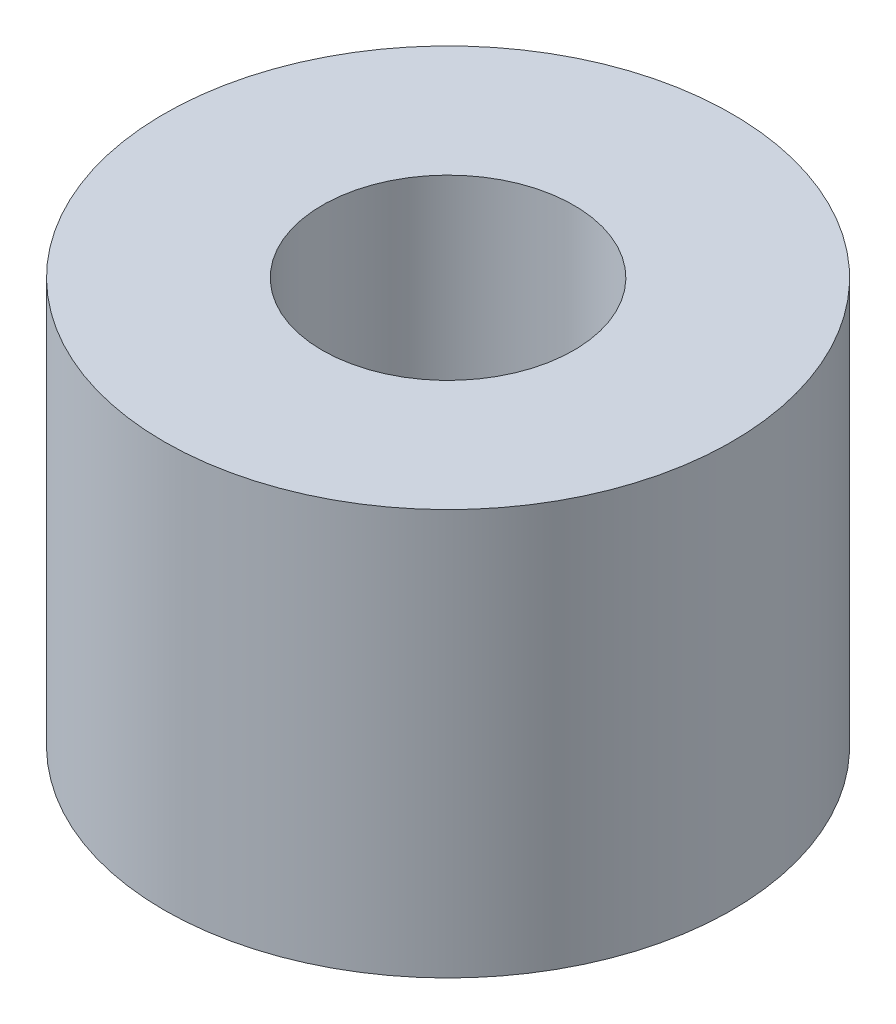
SolidWorks part; units mm, degrees
ref_plane "Front Plane" through (0, 0, 0) normal (0, 0, 1) x (1, 0, 0)
ref_plane "Top Plane" through (0, 0, 0) normal (0, 1, 0) x (1, 0, 0)
ref_plane "Right Plane" through (0, 0, 0) normal (1, 0, 0) x (0, 0, -1)
sketch "Sketch1" plane through (0, 0, 0) normal (0, 1, 0) x (1, 0, 0)
  circle A0 centre (0, 0) radius 1.55
  circle A1 centre (0, 0) radius 3.5
  dimension "D1" = 3.1
  dimension "D2" = 7
extrude "Boss-Extrude1" add sketch "Sketch1" along normal blind 5
